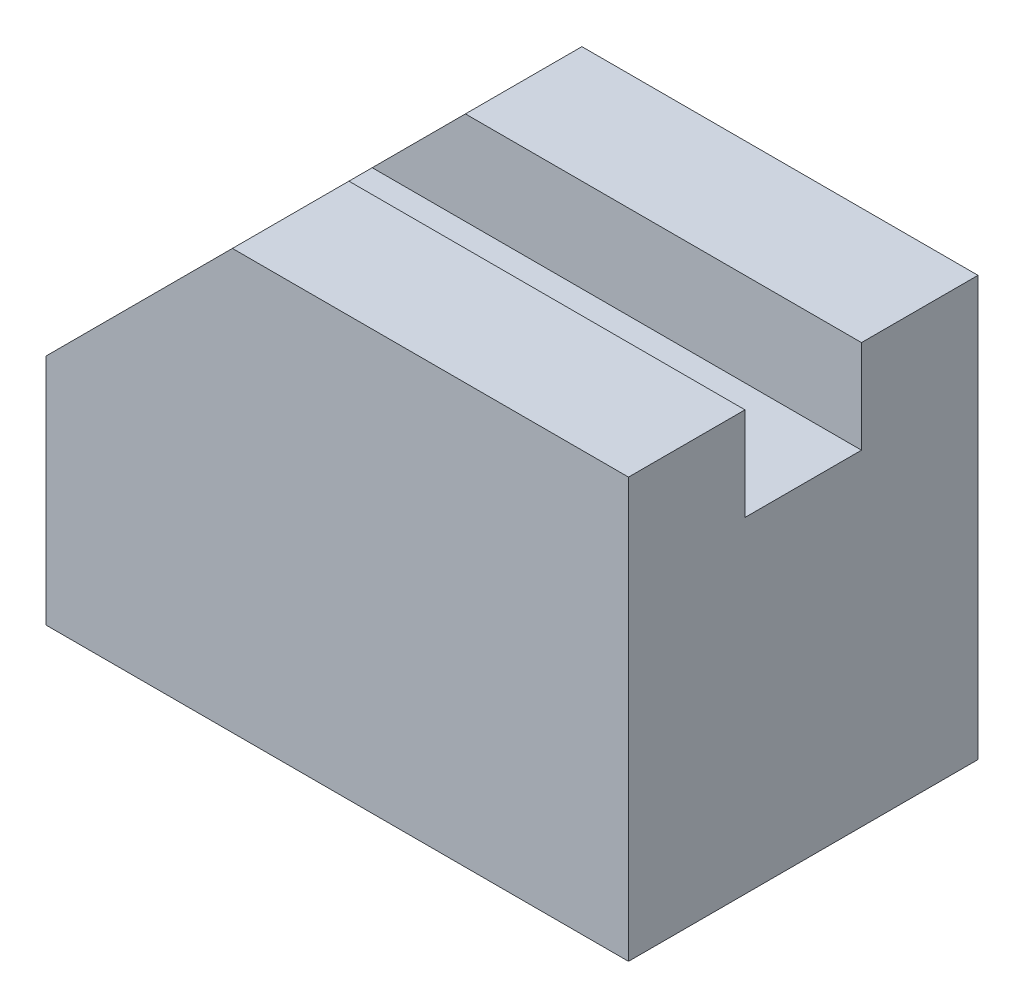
SolidWorks part; units mm, degrees
ref_plane "前视基准面" through (0, 0, 0) normal (0, 0, 1) x (1, 0, 0)
ref_plane "上视基准面" through (0, 0, 0) normal (0, 1, 0) x (1, 0, 0)
ref_plane "右视基准面" through (0, 0, 0) normal (1, 0, 0) x (0, 0, -1)
sketch "草图1" plane through (0, 0, 0) normal (0, 0, 1) x (1, 0, 0)
  line L0 (0, 0) -> (100, 0)
  line L1 (100, 0) -> (100, 72)
  line L2 (100, 72) -> (32, 72)
  line L3 (32, 72) -> (0, 40)
  line L4 (0, 40) -> (0, 0)
  dimension "D1" = 135
  dimension "D2" = 100
  dimension "D3" = 72
  dimension "D4" = 40
extrude "拉伸1" add sketch "草图1" along normal mid plane 60
sketch "草图3" plane through (0, 0, 0) normal (0, 0, 1) x (1, 0, 0)
  line L0 (16, 56) -> (100, 56)
  line L3 (32, 72) -> (0, 40) construction
  line L4 (100, 0) -> (100, 72) construction
  line L6 (100, 56) -> (100, 72)
  line L7 (100, 72) -> (32, 72)
  line L8 (32, 72) -> (16, 56)
extrude "切除-拉伸3" cut sketch "草图3" against normal mid plane 20
sketch "草图4" plane through (0, 0, 0) normal (0, 0, 1) x (1, 0, 0)
  line L0 (16, 56) -> (0, 40)
  line L1 (32, 72) -> (0, 40) construction
  line L2 (0, 40) -> (0, 0)
  line L3 (0, 0) -> (16, 0)
  line L4 (0, 0) -> (100, 0) construction
  line L5 (16, 0) -> (16, 56)
extrude "切除-拉伸4" cut sketch "草图4" against normal mid plane 20
